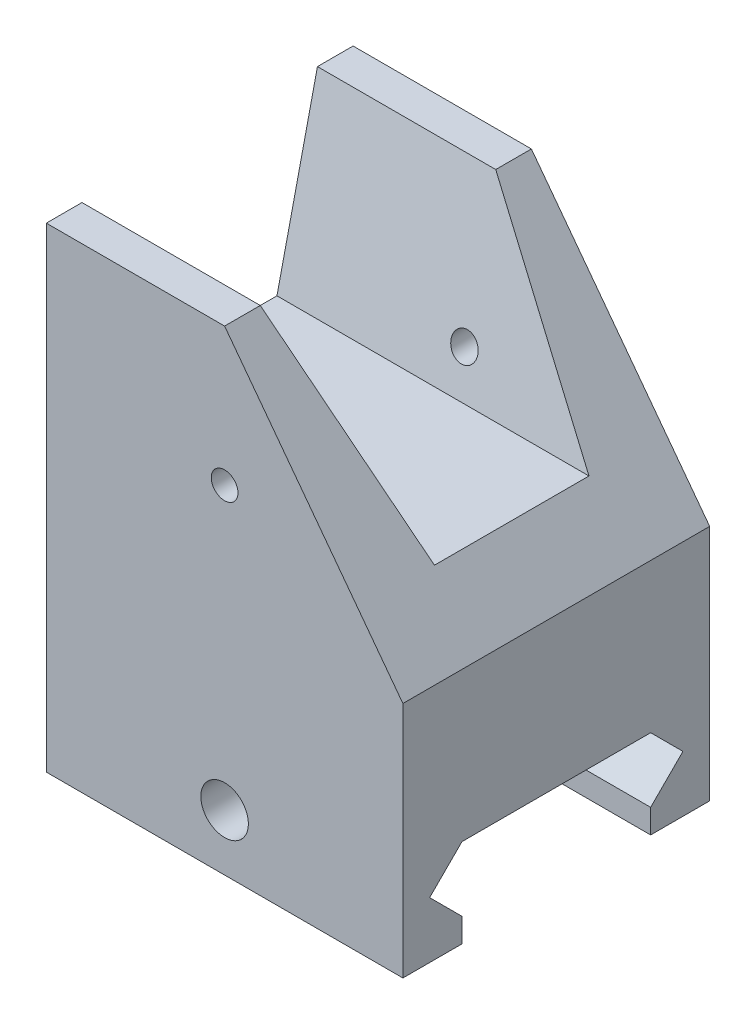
SolidWorks part; units mm, degrees
ref_plane "Front Plane" through (0, 0, 0) normal (0, 0, 1) x (1, 0, 0)
ref_plane "Top Plane" through (0, 0, 0) normal (0, 1, 0) x (1, 0, 0)
ref_plane "Right Plane" through (0, 0, 0) normal (1, 0, 0) x (0, 0, -1)
sketch "Sketch1" plane through (0, 0, 0) normal (0, 0, 1) x (1, 0, 0)
  line L0 (30, 0) -> (0, 0)
  line L1 (30, 0) -> (30, 20)
  line L2 (15, 40) -> (0, 40)
  line L3 (0, 0) -> (0, 40)
  line L4 (30, 20) -> (15, 40)
  dimension "D1" = 40
  dimension "D2" = 30
extrude "Boss-Extrude1" add sketch "Sketch1" along normal mid plane 25.81
sketch "Sketch2" plane through (0, 0, 0) normal (1, 0, 0) x (0, 0, -1)
  line L0 (7.9372, 0) -> (7.9372, 2.0143)
  line L1 (-7.9378, 2.0143) -> (-7.9378, 0)
  line L2 (-10.6556, 4.7321) -> (-7.9378, 2.0143)
  line L3 (-7.9378, 7.4499) -> (-10.6556, 4.7321)
  line L4 (7.9372, 7.4499) -> (-7.9378, 7.4499)
  line L5 (10.655, 4.7321) -> (7.9372, 7.4499)
  line L6 (7.9372, 2.0143) -> (10.655, 4.7321)
  line L7 (-12.905, 0) -> (12.905, 0) construction
  line L8 (12.905, 40) -> (12.905, 0) construction
  line L9 (7.9372, 0) -> (7.9372, -1.3801)
  line L10 (7.9372, -1.3801) -> (-7.9378, -1.3801)
  line L11 (-7.9378, -1.3801) -> (-7.9378, 0)
  line L12 (9.905, 40) -> (6.5, 25)
  line L13 (-12.905, 40) -> (12.905, 40) construction
  line L14 (6.5, 25) -> (-6.5, 25)
  line L15 (-6.5, 25) -> (-9.905, 40)
  line L17 (-12.905, 40) -> (-12.905, 0) construction
  line L18 (9.905, 40) -> (9.905, 43.8299)
  line L19 (9.905, 43.8299) -> (-9.905, 43.8299)
  line L20 (-9.905, 43.8299) -> (-9.905, 40)
  point P9 (10.655, 4.7321)
  dimension "D1" = 4.7321
  dimension "D2" = 2.25
  dimension "D3" = 3
  dimension "D4" = 3
  dimension "D5" = 13
  dimension "D6" = 6.405
  dimension "D7" = 15
extrude "Cut-Extrude1" cut sketch "Sketch2" along normal through all
sketch "Sketch3" plane through (0, 0, 0) normal (0, 0, 1) x (1, 0, 0)
  circle A0 centre (15, 4.7321) radius 2
  circle A1 centre (15, 28.3992) radius 1.125
  dimension "D1" = 4
  dimension "D2" = 2.25
extrude "Cut-Extrude2" cut sketch "Sketch3" against normal mid plane 26
